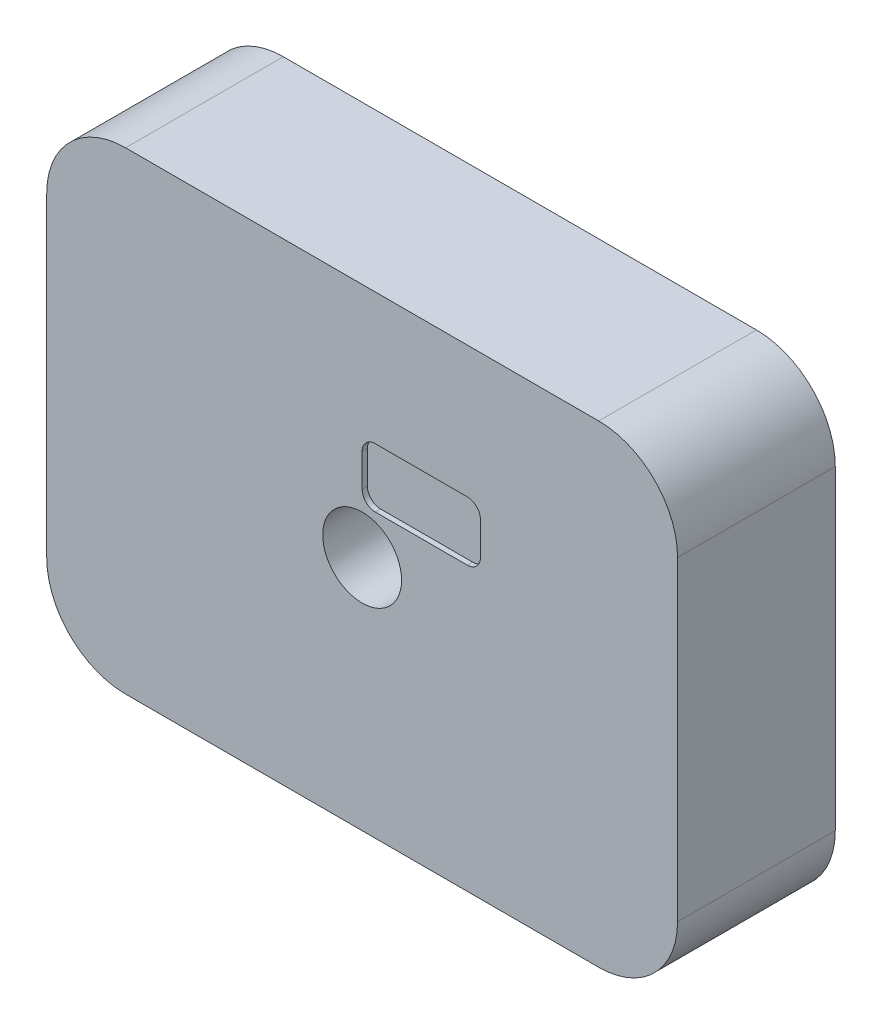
SolidWorks part; units mm, degrees
ref_plane "Plan de face" through (0, 0, 0) normal (0, 0, 1) x (1, 0, 0)
ref_plane "Plan de dessus" through (0, 0, 0) normal (0, 1, 0) x (1, 0, 0)
ref_plane "Plan de droite" through (0, 0, 0) normal (1, 0, 0) x (0, 0, -1)
sketch "Esquisse1" plane through (0, 0, 0) normal (0, 0, 1) x (1, 0, 0)
  line L0 (0, 26.5556) -> (0, -31.9133) construction
  line L1 (-24, 18) -> (24, 18)
  line L2 (-24, 18) -> (-24, -18)
  line L3 (-24, -18) -> (24, -18)
  line L4 (24, 18) -> (24, -18)
  line L5 (-36.2228, 0) -> (39.251, 0) construction
  dimension "D1" = 36
  dimension "D2" = 48
extrude "Extrusion1" add sketch "Esquisse1" along normal blind 12
sketch "Esquisse12" plane through (0, 0, 12) normal (0, 0, 1) x (1, 0, 0)
  circle A0 centre (0, 0) radius 3
  dimension "D1" = 6
extrude "Enlèv. mat.-Extru.5" cut sketch "Esquisse12" against normal through all
chamfer "Chanfrein1" distance 0.5 angle 45 1 edges at (3, 0, 0)
hole_wizard "Trou taraudé M41" positions "Esquisse11" profile "Esquisse10" tap size "M4" standard "ISO"
sketch "Esquisse11" plane through (0, 0, 0) normal (0, 0, -1) x (-1, 0, 0)
  line L0 (0, 4.0835) -> (0, -4.1463) construction
  line L2 (-4.8688, 0) -> (4.6803, 0) construction
  point P0 (18, 12)
  point P1 (-18, 12)
  point P3 (-18, -12)
  point P5 (18, -12)
  dimension "D1" = 18
  dimension "D2" = 12
sketch "Esquisse10" plane through (-18, 12, 0) normal (1, 0, 0) x (0, 1, 0)
  line L0 (0, 0) -> (0, 11.0914)
  line L1 (0, 11.0914) -> (1.65, 10.1)
  line L2 (1.65, 10.1) -> (1.65, 0)
  line L5 (1.65, 0) -> (0, 0)
  line L10 (0, 11.0914) -> (-1.65, 10.1) construction
  line L11 (0, -6.35) -> (0, 107.95) construction
  dimension "Diamètre du trou pour taraudage" = 3.3
  dimension "Profondeur du trou pour taraudage" = 10.1
  dimension "Angle de pointe" = 118
fillet "Congé1" radius 6 4 edges at (24, -18, 6) (24, 18, 6) (-24, -18, 6) (-24, 18, 6)
sketch "Esquisse8" plane through (0, 0, 12) normal (0, 0, 1) x (1, 0, 0)
  line L0 (-2.3559, 0) -> (5.497, 0) construction
  line L1 (1, 8) -> (8, 8)
  line L2 (0, 7) -> (0, 4.5)
  line L3 (1, 3.5) -> (8, 3.5)
  line L4 (9, 7) -> (9, 4.5)
  arc A0 (8, 3.5) -> (9, 4.5) centre (8, 4.5) ccw
  arc A1 (8, 8) -> (9, 7) centre (8, 7) cw
  arc A2 (1, 8) -> (0, 7) centre (1, 7) ccw
  arc A3 (0, 4.5) -> (1, 3.5) centre (1, 4.5) ccw
  dimension "D4" = 1
  dimension "D1" = 3.5
  dimension "D2" = 9
  dimension "D3" = 4.5
extrude "Enlèv. mat.-Extru.4" cut sketch "Esquisse8" against normal blind 0.4
sketch "Esquisse9" plane through (0, 0, 11.6) normal (0, 0, 1) x (1, 0, 0)
  line L0 (9, 6.5) -> (0, 6.5) construction
  line L2 (0, 7) -> (0, 4.5) construction
  line L3 (8, 8) -> (1, 8) construction
  line L16 (9, 4.5) -> (9, 7) construction
  text T0 "O M M" font "Century Gothic" height in points 6
  dimension "D1" = 1.5
